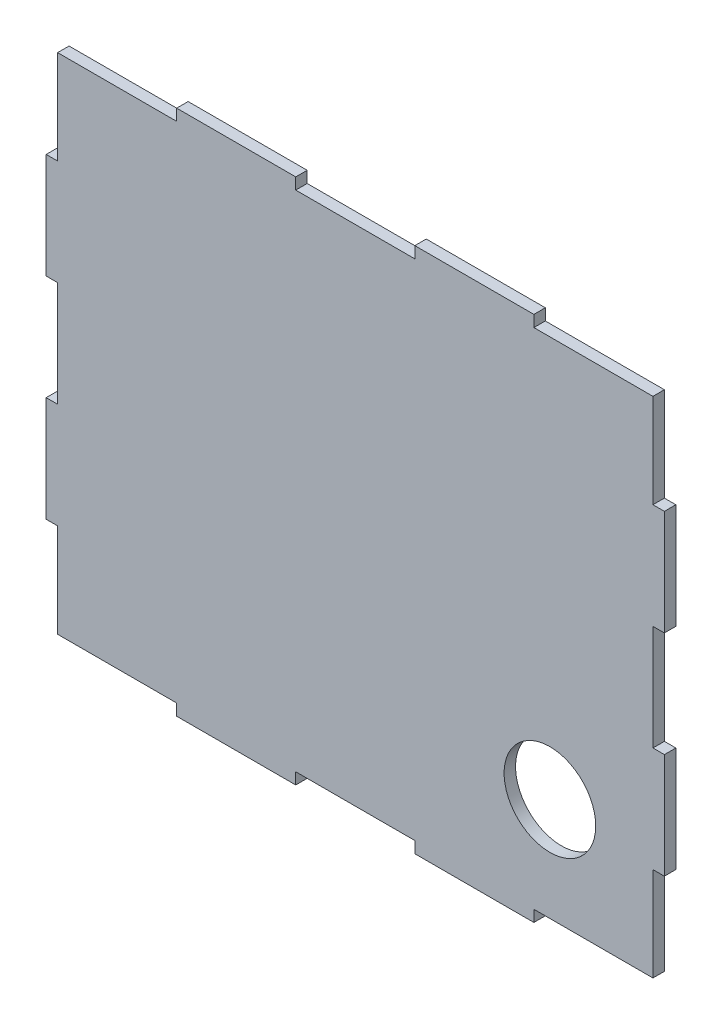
SolidWorks part; units mm, degrees
ref_plane "Front Plane" through (0, 0, 0) normal (0, 0, 1) x (1, 0, 0)
ref_plane "Top Plane" through (0, 0, 0) normal (0, 1, 0) x (1, 0, 0)
ref_plane "Right Plane" through (0, 0, 0) normal (1, 0, 0) x (0, 0, -1)
ref_plane "Plane1" through (0, 0, 0) normal (0, 0, -1) x (-1, 0, 0)
sketch "Sketch1" plane through (0, 0, 0) normal (0, 0, -1) x (-1, 0, 0)
  line L0 (-36.195, 143.2348) -> (-36.195, 146.4098)
  line L1 (-36.195, 146.4098) -> (-69.215, 146.4098)
  line L2 (-69.215, 146.4098) -> (-69.215, 143.2348)
  line L3 (-69.215, 143.2348) -> (-102.235, 143.2348)
  line L4 (-102.235, 143.2348) -> (-102.235, 146.4098)
  line L5 (-102.235, 146.4098) -> (-135.255, 146.4098)
  line L6 (-135.255, 146.4098) -> (-135.255, 143.2348)
  line L7 (-135.255, 143.2348) -> (-168.275, 143.2348)
  line L8 (-168.275, 143.2348) -> (-168.275, 117.1998)
  line L9 (-168.275, 117.1998) -> (-171.45, 117.1998)
  line L10 (-171.45, 117.1998) -> (-171.45, 87.9898)
  line L11 (-171.45, 87.9898) -> (-168.275, 87.9898)
  line L12 (-168.275, 87.9898) -> (-168.275, 58.7798)
  line L13 (-168.275, 58.7798) -> (-171.45, 58.7798)
  line L14 (-171.45, 58.7798) -> (-171.45, 29.5698)
  line L15 (-171.45, 29.5698) -> (-168.275, 29.5698)
  line L16 (-168.275, 29.5698) -> (-168.275, 3.5348)
  line L17 (-168.275, 3.5348) -> (-135.255, 3.5348)
  line L18 (-135.255, 3.5348) -> (-135.255, 0.3598)
  line L19 (-135.255, 0.3598) -> (-102.235, 0.3598)
  line L20 (-102.235, 0.3598) -> (-102.235, 3.5348)
  line L21 (-102.235, 3.5348) -> (-69.215, 3.5348)
  line L22 (-69.215, 3.5348) -> (-69.215, 0.3598)
  line L23 (-69.215, 0.3598) -> (-36.195, 0.3598)
  line L24 (-36.195, 0.3598) -> (-36.195, 3.5348)
  line L25 (-36.195, 3.5348) -> (-3.175, 3.5348)
  line L26 (-3.175, 3.5348) -> (-3.175, 29.5698)
  line L27 (-3.175, 29.5698) -> (0, 29.5698)
  line L28 (0, 29.5698) -> (0, 58.7798)
  line L29 (0, 58.7798) -> (-3.175, 58.7798)
  line L30 (-3.175, 58.7798) -> (-3.175, 87.9898)
  line L31 (-3.175, 87.9898) -> (0, 87.9898)
  line L32 (0, 87.9898) -> (0, 117.1998)
  line L33 (0, 117.1998) -> (-3.175, 117.1998)
  line L34 (-3.175, 117.1998) -> (-3.175, 143.2348)
  line L35 (-3.175, 143.2348) -> (-36.195, 143.2348)
  circle A0 centre (-139.7, 32.1098) radius 12.7
  dimension "D1" = 25.4
  dimension "D2" = 3.175
  dimension "D3" = 31.75
  dimension "D4" = 36.195
  dimension "D5" = 69.215
  dimension "D6" = 102.235
  dimension "D7" = 135.255
  dimension "D8" = 168.275
  dimension "D9" = 171.45
  dimension "D10" = 3.175
  dimension "D11" = 29.21
  dimension "D12" = 31.75
  dimension "D13" = 58.42
  dimension "D14" = 87.63
  dimension "D15" = 116.84
  dimension "D16" = 142.875
  dimension "D17" = 146.05
extrude "Boss-Extrude1" add sketch "Sketch1" against normal blind 3.175
